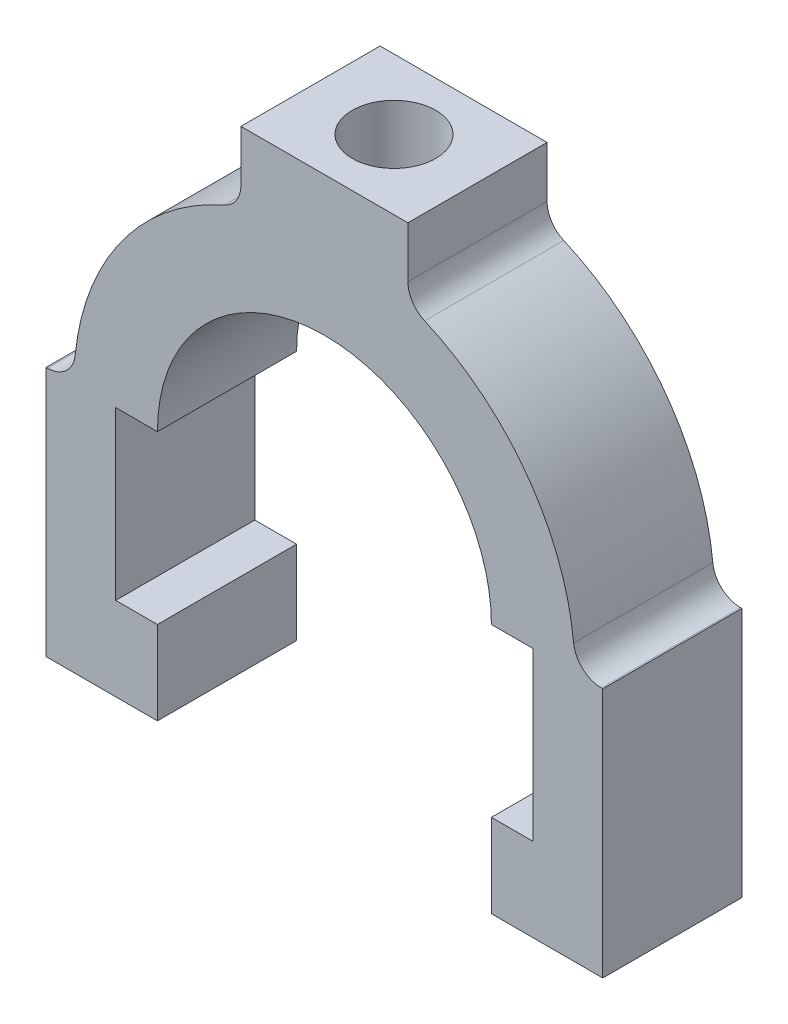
SolidWorks part; units mm, degrees
ref_plane "Front Plane" through (0, 0, 0) normal (0, 0, 1) x (1, 0, 0)
ref_plane "Top Plane" through (0, 0, 0) normal (0, 1, 0) x (1, 0, 0)
ref_plane "Right Plane" through (0, 0, 0) normal (1, 0, 0) x (0, 0, -1)
sketch "Sketch1" plane through (0, 0, 0) normal (0, 0, 1) x (1, 0, 0)
  line L0 (30, 6) -> (30, 30) construction
  line L1 (24, 6) -> (30, 6) construction
  line L2 (24, -6) -> (24, 6) construction
  line L3 (-30, 30) -> (-30, 6) construction
  line L4 (-30, 6) -> (-24, 6) construction
  line L5 (-24, 6) -> (-24, -6) construction
  line L6 (30, 6) -> (30, 30)
  line L7 (24, 6) -> (30, 6)
  line L8 (24, -6) -> (24, 6)
  line L9 (-30, 30) -> (-30, 6)
  line L10 (-30, 6) -> (-24, 6)
  line L11 (-24, 6) -> (-24, -6)
  line L12 (30, -6) -> (24, -6) construction
  line L13 (-24, -6) -> (-30, -6) construction
  line L14 (30, -6) -> (24, -6)
  line L15 (-24, -6) -> (-30, -6)
  line L16 (-30, -6) -> (-40, -6)
  line L17 (-40, -6) -> (-40, 30)
  line L18 (-40, 30) -> (-36, 30)
  line L19 (30, -6) -> (40, -6)
  line L20 (40, -6) -> (40, 30)
  line L21 (40, 30) -> (36, 30)
  line L22 (0, 0) -> (0, 63.9411) construction
  line L23 (-7.8812, 30) -> (7.5883, 30) construction
  line L24 (-20, 30) -> (-30, 30) construction
  line L25 (30, 30) -> (20, 30) construction
  line L26 (30, 30) -> (24, 30)
  line L27 (-24, 30) -> (-30, 30)
  line L28 (-12, 63.9411) -> (-12, 74)
  line L31 (-12, 74) -> (12, 74)
  line L32 (12, 63.9411) -> (12, 74)
  arc A1 (36, 30) -> (12, 63.9411) centre (0, 30) ccw
  arc A2 (24, 30) -> (-24, 30) centre (0, 30) ccw
  arc A3 (-12, 63.9411) -> (-36, 30) centre (0, 30) ccw
  dimension "D2" = 36
  dimension "D3" = 24
  dimension "D1" = 16
  dimension "D4" = 36
  dimension "D5" = 80
  dimension "D6" = 24
extrude "Boss-Extrude1" add sketch "Sketch1" along normal mid plane 20
sketch "Sketch2" plane through (0, 74, 0) normal (0, 1, 0) x (1, 0, 0)
  circle A0 centre (0, 0) radius 6
  dimension "D1" = 12
extrude "Cut-Extrude1" cut sketch "Sketch2" against normal up to next
fillet "Fillet1" radius 4 4 edges at (-36, 30, 0) (-12, 63.9411, 0) (36, 30, 0) (12, 63.9411, 0)
